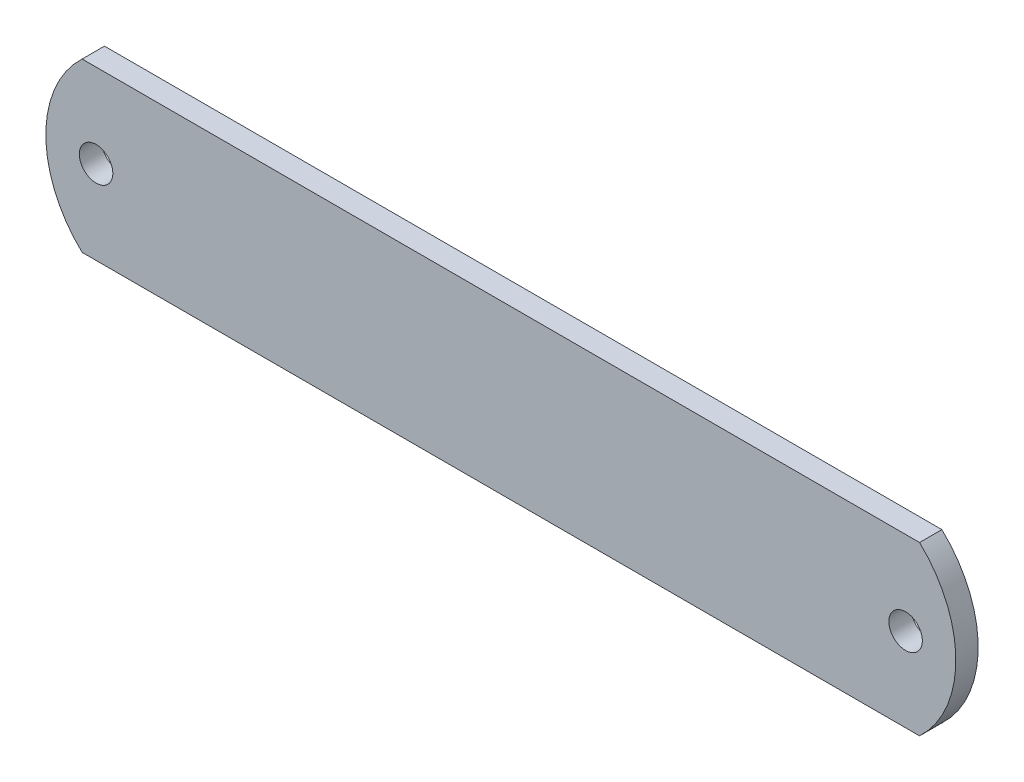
SolidWorks part; units mm, degrees
ref_plane "Спереди" through (0, 0, 0) normal (0, 0, 1) x (1, 0, 0)
ref_plane "Сверху" through (0, 0, 0) normal (0, 1, 0) x (1, 0, 0)
ref_plane "Справа" through (0, 0, 0) normal (1, 0, 0) x (0, 0, -1)
sketch "Эскиз1" plane through (0, 0, 0) normal (0, 0, 1) x (1, 0, 0)
  line L0 (0, 15) -> (163, 15) construction
  line L1 (0, 0) -> (163, 0) construction
  line L2 (0, 0) -> (0, 30) construction
  line L3 (0, 30) -> (163, 30) construction
  line L4 (163, 0) -> (163, 30) construction
  line L5 (81.5, 15) -> (81.5, 53.7268) construction
  line L6 (6.5, 30) -> (156.5, 30)
  line L7 (6.5, 0) -> (156.5, 0)
  circle A0 centre (9, 15) radius 3
  arc A1 (6.5, 0) -> (6.5, 30) centre (20.5577, 15) cw
  arc A2 (156.5, 0) -> (156.5, 30) centre (142.4423, 15) ccw
  circle A3 centre (154, 15) radius 3
  dimension "D3" = 6
  dimension "D1" = 163
  dimension "D2" = 30
  dimension "D4" = 75
  dimension "D5" = 72.5
extrude "Бобышка-Вытянуть1" add sketch "Эскиз1" along normal blind 4
move or copy body "Тело-Переместить/Копировать2" [suppressed] bodies to move or copy 103
move or copy body "Тело-Переместить/Копировать1" [suppressed] bodies to move or copy 103
